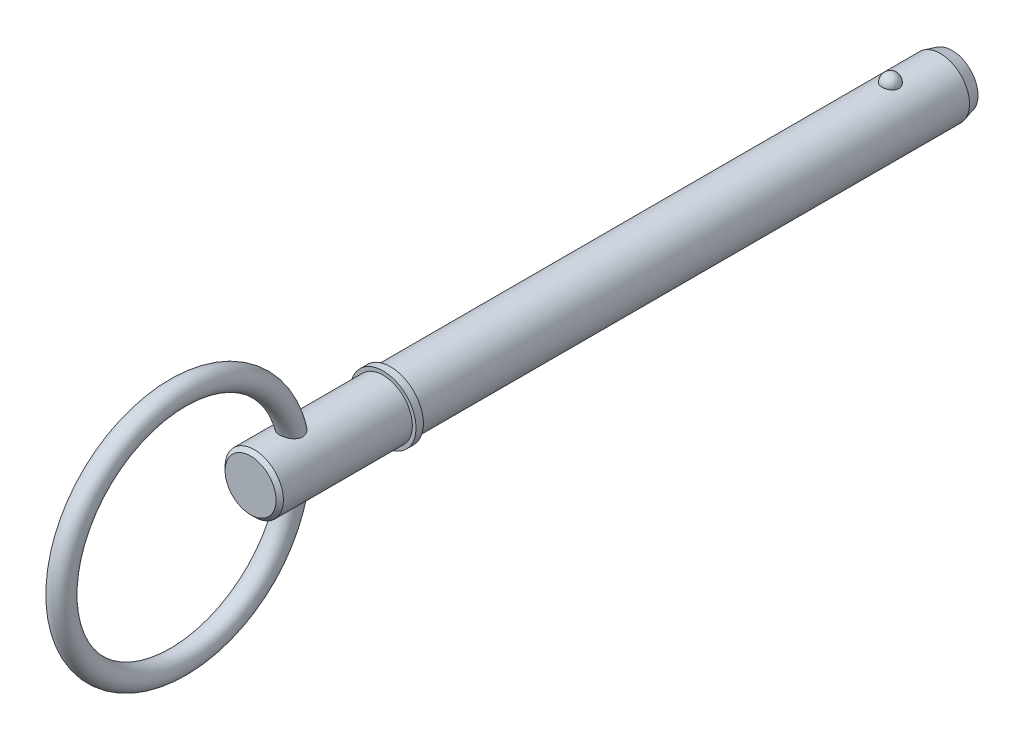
SolidWorks part; units mm, degrees
ref_plane "Front Plane" through (0, 0, 0) normal (0, 0, 1) x (1, 0, 0)
ref_plane "Top Plane" through (0, 0, 0) normal (0, 1, 0) x (1, 0, 0)
ref_plane "Right Plane" through (0, 0, 0) normal (1, 0, 0) x (0, 0, -1)
sketch "Sketch2" plane through (0, 0, 0) normal (0, 0, 1) x (1, 0, 0)
  circle A0 centre (0, 0) radius 3.97
  point P3 (0, 3.97)
  dimension "D1" = 7.94
extrude "Boss-Extrude1" add sketch "Sketch2" along normal blind 66.9
sketch "Sketch3" plane through (0, 0, 0) normal (0, 0, -1) x (-1, 0, 0)
  circle A0 centre (0, 0) radius 3.97
  dimension "D1" = 7.94
extrude "Boss-Extrude2" add sketch "Sketch3" along normal blind 9.53
chamfer "Chamfer1" distance 1.586 angle 15 1 edges at (-3.97, 0, -9.53)
sketch "Sketch18" plane through (0, 0, 0) normal (1, 0, 0) x (0, 0, -1)
  line L0 (7.944, 3.97) -> (-66.9, 3.97) construction
  line L1 (1.15, 5.12) -> (1.15, 2.82)
  line L2 (-66.9, -3.97) -> (7.944, -3.97) construction
  arc A0 (1.15, 5.12) -> (1.15, 2.82) centre (1.15, 3.97) ccw
  point P4 (0, 3.97)
  dimension "D1" = 9.09
revolve "Revolve1" add sketch "Sketch18" angle 360 about L1
sketch "Sketch19" plane through (0, 0, 0) normal (1, 0, 0) x (0, 0, -1)
  line L0 (-33.7288, 0) -> (-46.4542, 0) construction
sketch "Sketch20" plane through (0, 0, 0) normal (1, 0, 0) x (0, 0, -1)
  line L0 (-66.9, 0) -> (-66.9, 4.47)
  line L1 (-66.9, 3.97) -> (-66.9, -3.97) construction
  line L2 (-66.9, 4.47) -> (-67.9, 4.47)
  line L3 (-67.9, 4.47) -> (-67.9, 0)
  line L4 (-33.7288, 0) -> (-46.4542, 0) construction
  line L5 (-67.9, 0) -> (-66.9, 0)
  dimension "D1" = 4.47
  dimension "D2" = 1
revolve "Revolve2" add sketch "Sketch20" angle 360 about L0
sketch "Sketch21" plane through (0, 0, 66.9) normal (0, 0, -1) x (-1, 0, 0)
  circle A0 centre (0, 0) radius 3.97
  dimension "D1" = 7.94
extrude "Boss-Extrude3" add sketch "Sketch21" against normal blind 19.05
chamfer "Chamfer2" distance 0.5 angle 45 1 edges at (-3.97, 0, 85.95)
sketch "Sketch23" plane through (0, 0, 0) normal (1, 0, 0) x (0, 0, -1)
  line L0 (-85.95, 3.47) -> (-85.95, -3.47) construction
  circle A0 centre (-95.825, 0) radius 15.875
  point P2 (-79.95, 0)
  dimension "D1" = 31.75
  dimension "D2" = 6
sketch "Sketch24" plane through (0, 0, 0) normal (0, 1, 0) x (1, 0, 0)
  circle A0 centre (0, -79.95) radius 1.5
  dimension "D1" = 3
sweep "Sweep1" add profiles "Sketch24" path "Sketch23"
